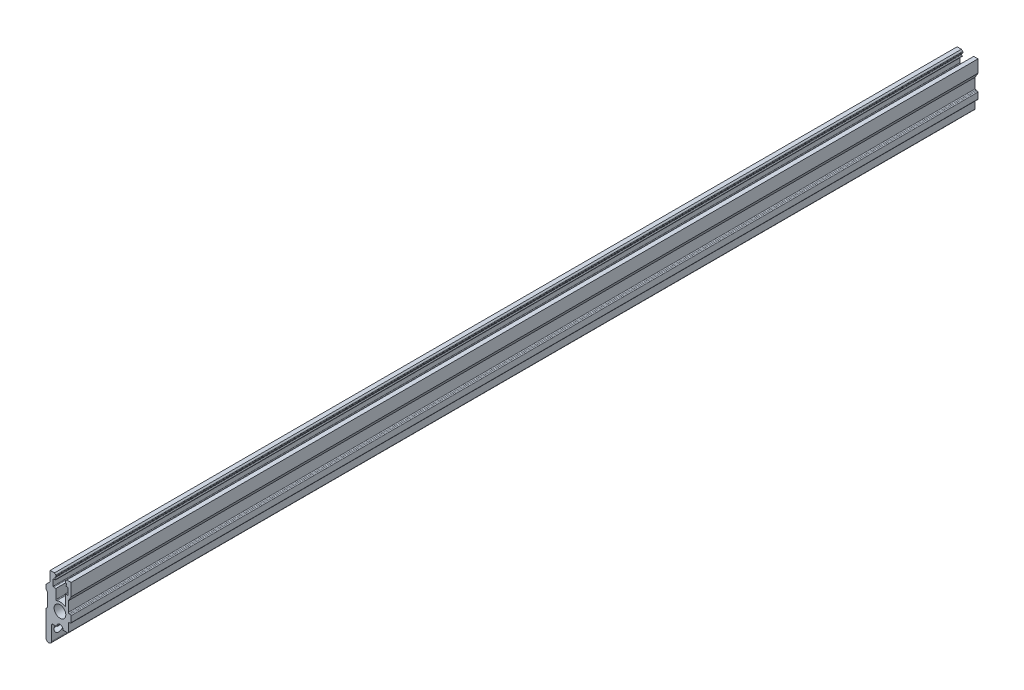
SolidWorks part; units mm, degrees
ref_plane "前视基准面" through (0, 0, 0) normal (0, 0, 1) x (1, 0, 0)
ref_plane "上视基准面" through (0, 0, 0) normal (0, 1, 0) x (1, 0, 0)
ref_plane "右视基准面" through (0, 0, 0) normal (1, 0, 0) x (0, 0, -1)
sketch "草图1" plane through (0, 0, 0) normal (0, 0, 1) x (1, 0, 0)
  line L0 (-2.3509, 8.9116) -> (-2.3509, 6.6116)
  line L1 (-2.3509, 8.9116) -> (-1.4509, 8.9116)
  line L2 (-1.4509, 8.9116) -> (-1.4509, 11.7916)
  line L3 (-1.4509, 11.7916) -> (-4.1259, 11.7916)
  line L4 (-4.1259, 11.7916) -> (-4.1259, 10.0616)
  line L5 (-4.1259, 10.0616) -> (-3.5009, 9.8916)
  line L6 (-3.5009, 9.8916) -> (-3.5009, 8.5216)
  line L7 (-3.5009, 8.5216) -> (-5.0009, 8.5216)
  line L8 (-5.0009, 8.5216) -> (-5.0009, 4.4416)
  line L9 (-5.0009, 4.4416) -> (-4.5507, 3.9414)
  line L10 (-4.5507, 3.9414) -> (-4.551, -1.0586)
  line L11 (-4.551, -1.0586) -> (-5.0009, -1.5584)
  line L12 (-5.0009, -1.5584) -> (-5.0009, -10.75)
  line L13 (-3.0009, -10.75) -> (-3.0009, -5.75)
  line L14 (2.9991, -5.05) -> (2.9991, -2.0584)
  line L15 (3.2991, -1.7584) -> (3.6991, -1.7584)
  line L16 (3.9991, -2.0584) -> (3.9991, -3.4584) construction
  line L17 (4.2991, -3.7584) -> (4.6991, -3.7584) construction
  line L18 (4.9991, -3.4584) -> (4.9991, 2.6416) construction
  line L19 (4.6991, 2.9416) -> (4.2991, 2.9416) construction
  line L20 (3.9991, 2.6416) -> (3.9991, 1.2416) construction
  line L21 (3.6991, 0.9416) -> (3.2991, 0.9416)
  line L22 (2.9991, 1.2416) -> (2.9991, 4.8054)
  line L23 (2.9991, 4.8054) -> (3.9991, 6.5374)
  line L24 (3.9991, 6.5374) -> (3.9991, 9.5216)
  line L25 (3.9991, 9.5216) -> (3.1241, 9.5216)
  line L26 (3.1241, 10.7916) -> (3.1241, 11.7916)
  line L27 (3.1241, 11.7916) -> (1.9491, 11.7916)
  line L28 (1.9491, 11.7916) -> (1.9491, 8.9116)
  line L29 (1.9491, 8.9116) -> (2.8491, 8.9116)
  line L30 (2.8491, 6.6116) -> (2.8491, 8.9116)
  line L31 (2.8491, 6.6116) -> (1.9491, 6.6116)
  line L32 (1.9491, 6.6116) -> (1.9491, 2.6797)
  line L33 (-1.4509, 2.9454) -> (-1.4509, 6.6116)
  line L34 (-1.4509, 6.6116) -> (-2.3509, 6.6116)
  line L35 (0, 0) -> (0, -5) construction
  line L36 (-1.05, -5) -> (-1.05, -5.15)
  line L37 (1.05, -5) -> (1.05, -5.15)
  line L38 (1.15, -5.25) -> (2.7991, -5.25)
  line L39 (-2.5009, -5.25) -> (-1.15, -5.25)
  line L40 (-1.4509, 10.3516) -> (1.9491, 10.3516) construction
  line L41 (-3.0009, -10.75) -> (-5.0009, -10.75) construction
  line L42 (0.2491, 10.3516) -> (0.2491, 6.8507) construction
  line L44 (3.9991, 0.6416) -> (3.9991, -1.4584)
  arc A0 (-5.0009, -10.75) -> (-3.0009, -10.75) centre (-4.0009, -10.75) ccw
  arc A1 (3.2991, -1.7584) -> (2.9991, -2.0584) centre (3.2991, -2.0584) ccw
  arc A2 (3.9991, -2.0584) -> (3.6991, -1.7584) centre (3.6991, -2.0584) ccw construction
  arc A3 (3.9991, -3.4584) -> (4.2991, -3.7584) centre (4.2991, -3.4584) ccw construction
  arc A4 (4.6991, -3.7584) -> (4.9991, -3.4584) centre (4.6991, -3.4584) ccw construction
  arc A5 (4.9991, 2.6416) -> (4.6991, 2.9416) centre (4.6991, 2.6416) ccw construction
  arc A6 (4.2991, 2.9416) -> (3.9991, 2.6416) centre (4.2991, 2.6416) ccw construction
  arc A7 (3.6991, 0.9416) -> (3.9991, 1.2416) centre (3.6991, 1.2416) ccw construction
  arc A8 (2.9991, 1.2416) -> (3.2991, 0.9416) centre (3.2991, 1.2416) ccw
  arc A9 (3.1241, 10.7916) -> (3.1241, 9.5216) centre (3.1841, 10.1566) ccw
  circle A10 centre (0, 0) radius 1.6
  arc A11 (1.6398, 2.5122) -> (-1.1727, 2.7613) centre (0, 0) ccw
  arc A12 (1.6398, 2.5122) -> (1.9491, 2.6797) centre (1.7491, 2.6797) ccw
  arc A13 (-1.4509, 2.9454) -> (-1.1727, 2.7613) centre (-1.2509, 2.9454) ccw
  arc A14 (1.05, -5) -> (-1.05, -5) centre (0, -5) ccw
  arc A15 (1.15, -5.25) -> (1.05, -5.15) centre (1.15, -5.15) cw
  arc A16 (-1.05, -5.15) -> (-1.15, -5.25) centre (-1.15, -5.15) cw
  arc A17 (3.6991, 0.9416) -> (3.9991, 0.6416) centre (3.6991, 0.6416) cw
  arc A18 (3.9991, -1.4584) -> (3.6991, -1.7584) centre (3.6991, -1.4584) cw
  arc A19 (2.7991, -5.25) -> (2.9991, -5.05) centre (2.7991, -5.05) ccw
  arc A20 (-3.0009, -5.75) -> (-2.5009, -5.25) centre (-2.5009, -5.75) cw
  point P72 (1.05, -5.25)
  dimension "D1" = 2.1
  dimension "D3" = 5
  dimension "D4" = 0.1
  dimension "D6" = 0.3
  dimension "D2" = 10.75
  dimension "D5" = 5.2
extrude "凸台-拉伸1" add sketch "草图1" along normal mid plane 325.12
sketch "草图9" plane through (0, 0, -162.56) normal (0, 0, -1) x (-1, 0, 0)
  line L0 (2.3509, 8.9116) -> (1.4509, 8.9116) construction
  line L1 (2.4509, 8.9116) -> (-2.9491, 8.9116)
  line L2 (2.4509, 8.9116) -> (2.4509, 6.4116)
  line L3 (2.4509, 6.4116) -> (-2.9491, 6.4116)
  line L4 (-2.9491, 8.9116) -> (-2.9491, 6.4116)
  line L5 (2.3509, 6.6116) -> (2.3509, 8.9116) construction
  line L6 (-2.8491, 8.9116) -> (-2.8491, 6.6116) construction
  line L7 (-2.8491, 6.6116) -> (-1.9491, 6.6116) construction
  dimension "D1" = 0.1
  dimension "D2" = 0.1
  dimension "D3" = 0.2
extrude "切除-拉伸7" cut sketch "草图9" against normal through all
fillet "圆角4" radius 0.2 4 edges at (-2.4509, 8.9116, 0) (-2.4509, 6.4116, 0) (2.9491, 8.9116, 0) (2.9491, 6.4116, 0)
sketch "草图2" plane through (0, 0, -162.56) normal (0, 0, -1) x (-1, 0, 0)
  circle A0 centre (0, 0) radius 2.1
  dimension "D1" = 4.2
extrude "切除-拉伸1" cut sketch "草图2" against normal blind 10
sketch "草图3" plane through (0, 0, 162.56) normal (0, 0, 1) x (1, 0, 0)
  circle A0 centre (0, 0) radius 2.1
  dimension "D1" = 4.2
extrude "切除-拉伸2" cut sketch "草图3" against normal blind 10
sketch "草图4" plane through (-5.0009, 0, 0) normal (-1, 0, 0) x (0, 0, 1)
  line L0 (-162.56, -1.5584) -> (-162.56, -10.75) construction
  line L1 (-162.56, -11.75) -> (162.56, -11.75) construction
  circle A0 centre (-160.02, -7.5) radius 1.65
  circle A1 centre (-154.94, -7.5) radius 1.65
  circle A2 centre (-149.86, -7.5) radius 1.65
  circle A3 centre (-144.78, -7.5) radius 1.65
  circle A4 centre (-139.7, -7.5) radius 1.65
  circle A5 centre (-134.62, -7.5) radius 1.65
  circle A6 centre (-129.54, -7.5) radius 1.65
  circle A7 centre (-124.46, -7.5) radius 1.65
  circle A8 centre (-119.38, -7.5) radius 1.65
  circle A9 centre (-114.3, -7.5) radius 1.65
  circle A10 centre (-109.22, -7.5) radius 1.65
  circle A11 centre (-104.14, -7.5) radius 1.65
  circle A12 centre (-99.06, -7.5) radius 1.65
  circle A13 centre (-93.98, -7.5) radius 1.65
  circle A14 centre (-88.9, -7.5) radius 1.65
  circle A15 centre (-83.82, -7.5) radius 1.65
  circle A16 centre (-78.74, -7.5) radius 1.65
  circle A17 centre (-73.66, -7.5) radius 1.65
  circle A18 centre (-68.58, -7.5) radius 1.65
  circle A19 centre (-63.5, -7.5) radius 1.65
  circle A20 centre (-58.42, -7.5) radius 1.65
  circle A21 centre (-53.34, -7.5) radius 1.65
  circle A22 centre (-48.26, -7.5) radius 1.65
  circle A23 centre (-43.18, -7.5) radius 1.65
  circle A24 centre (-38.1, -7.5) radius 1.65
  circle A25 centre (-33.02, -7.5) radius 1.65
  circle A26 centre (-27.94, -7.5) radius 1.65
  circle A27 centre (-22.86, -7.5) radius 1.65
  circle A28 centre (-17.78, -7.5) radius 1.65
  circle A29 centre (-12.7, -7.5) radius 1.65
  circle A30 centre (-7.62, -7.5) radius 1.65
  circle A31 centre (-2.54, -7.5) radius 1.65
  circle A32 centre (2.54, -7.5) radius 1.65
  circle A33 centre (7.62, -7.5) radius 1.65
  circle A34 centre (12.7, -7.5) radius 1.65
  circle A35 centre (17.78, -7.5) radius 1.65
  circle A36 centre (22.86, -7.5) radius 1.65
  circle A37 centre (27.94, -7.5) radius 1.65
  circle A38 centre (33.02, -7.5) radius 1.65
  circle A39 centre (38.1, -7.5) radius 1.65
  circle A40 centre (43.18, -7.5) radius 1.65
  circle A41 centre (48.26, -7.5) radius 1.65
  circle A42 centre (53.34, -7.5) radius 1.65
  circle A43 centre (58.42, -7.5) radius 1.65
  circle A44 centre (63.5, -7.5) radius 1.65
  circle A45 centre (68.58, -7.5) radius 1.65
  circle A46 centre (73.66, -7.5) radius 1.65
  circle A47 centre (78.74, -7.5) radius 1.65
  circle A48 centre (83.82, -7.5) radius 1.65
  circle A49 centre (88.9, -7.5) radius 1.65
  circle A50 centre (93.98, -7.5) radius 1.65
  circle A51 centre (99.06, -7.5) radius 1.65
  circle A52 centre (104.14, -7.5) radius 1.65
  circle A53 centre (109.22, -7.5) radius 1.65
  circle A54 centre (114.3, -7.5) radius 1.65
  circle A55 centre (119.38, -7.5) radius 1.65
  circle A56 centre (124.46, -7.5) radius 1.65
  circle A57 centre (129.54, -7.5) radius 1.65
  circle A58 centre (134.62, -7.5) radius 1.65
  circle A59 centre (139.7, -7.5) radius 1.65
  circle A60 centre (144.78, -7.5) radius 1.65
  circle A61 centre (149.86, -7.5) radius 1.65
  circle A62 centre (154.94, -7.5) radius 1.65
  circle A63 centre (160.02, -7.5) radius 1.65
  circle A64 centre (165.1, -7.5) radius 1.65
  circle A65 centre (170.18, -7.5) radius 1.65
  circle A66 centre (175.26, -7.5) radius 1.65
  circle A67 centre (180.34, -7.5) radius 1.65
  circle A68 centre (185.42, -7.5) radius 1.65
  circle A69 centre (190.5, -7.5) radius 1.65
  circle A70 centre (195.58, -7.5) radius 1.65
  circle A71 centre (200.66, -7.5) radius 1.65
  circle A72 centre (205.74, -7.5) radius 1.65
  circle A73 centre (210.82, -7.5) radius 1.65
  circle A74 centre (215.9, -7.5) radius 1.65
  circle A75 centre (220.98, -7.5) radius 1.65
  circle A76 centre (226.06, -7.5) radius 1.65
  circle A77 centre (231.14, -7.5) radius 1.65
  circle A78 centre (236.22, -7.5) radius 1.65
  circle A79 centre (241.3, -7.5) radius 1.65
  circle A80 centre (246.38, -7.5) radius 1.65
  circle A81 centre (251.46, -7.5) radius 1.65
  circle A82 centre (256.54, -7.5) radius 1.65
  circle A83 centre (261.62, -7.5) radius 1.65
  circle A84 centre (266.7, -7.5) radius 1.65
  dimension "D1" = 3.3
  dimension "D5" = 5.08
  dimension "D2" = 2.54
  dimension "D3" = 4.25
  dimension "D4" = 85
extrude "切除-拉伸3" cut sketch "草图4" against normal blind 12
sketch "草图5" plane through (0, 0, 162.56) normal (0, 0, 1) x (1, 0, 0)
  line L0 (1.9491, 8.9116) -> (2.7491, 8.9116) construction
  line L1 (1.9491, 8.9116) -> (3.9991, 8.9116)
  line L2 (1.9491, 8.9116) -> (1.9491, 11.7916)
  line L3 (1.9491, 11.7916) -> (3.9991, 11.7916)
  line L4 (3.9991, 8.9116) -> (3.9991, 11.7916)
  line L5 (3.1241, 11.7916) -> (1.9491, 11.7916) construction
  line L6 (3.9991, 6.5374) -> (3.9991, 9.5216) construction
  line L7 (-1.4509, 11.7916) -> (-4.1259, 11.7916) construction
  line L8 (-5.0009, 8.5216) -> (-2.7884, 8.5216)
  line L9 (-5.0009, 8.5216) -> (-5.0009, 11.7916)
  line L10 (-5.0009, 11.7916) -> (-2.7884, 11.7916)
  line L11 (-2.7884, 8.5216) -> (-2.7884, 11.7916)
extrude "凸台-拉伸2" add sketch "草图5" against normal up to surface (325.12 mm away)
sketch "草图6" plane through (0, 0, -162.56) normal (0, 0, -1) x (-1, 0, 0)
  line L0 (-1.9491, 9.4916) -> (1.4509, 9.4916) construction
  line L1 (-1.9491, 11.7916) -> (-1.9491, 8.9116) construction
  line L2 (1.4509, 8.9116) -> (1.4509, 11.7916) construction
  line L3 (1.4509, 11.7916) -> (5.0009, 11.7916) construction
  line L4 (-2.3491, 8.9916) -> (1.8509, 8.9916)
  line L5 (-2.3491, 8.9916) -> (-2.3491, 9.9916)
  line L6 (-2.3491, 9.9916) -> (1.8509, 9.9916)
  line L7 (1.8509, 8.9916) -> (1.8509, 9.9916)
  line L8 (-2.3491, 8.9916) -> (1.8509, 9.9916) construction
  line L9 (-2.3491, 9.9916) -> (1.8509, 8.9916) construction
  point P6 (-0.2491, 9.4916)
  dimension "D1" = 1
  dimension "D2" = 4.2
  dimension "D3" = 1.8
extrude "切除-拉伸4" cut sketch "草图6" against normal through all
sketch "草图8" plane through (0, 0, -162.56) normal (0, 0, -1) x (-1, 0, 0)
  line L0 (5.0009, 11.7916) -> (5.0009, 4.4416) construction
  line L1 (-3.9991, 11.7916) -> (5.0009, 11.7916)
  line L2 (-3.9991, 11.7916) -> (-3.9991, 11.0016)
  line L3 (-3.9991, 11.0016) -> (5.0009, 11.0016)
  line L4 (5.0009, 11.7916) -> (5.0009, 11.0016)
  dimension "D1" = 0.79
extrude "切除-拉伸6" cut sketch "草图8" against normal through all
fillet "圆角1" radius 0.5 4 edges at (-1.8509, 9.9916, 0) (-1.8509, 8.9916, 0) (2.3491, 9.9916, 0) (2.3491, 8.9916, 0)
chamfer "倒角1" distance 0.5 angle 45 2 edges at (-1.4509, 11.0016, 0) (1.9491, 11.0016, 0)
fillet "圆角2" radius 0.2 6 edges at (1.9491, 10.5016, 0) (-1.4509, 10.5016, 0) (-1.4509, 8.9916, 0) (-1.4509, 9.9916, 0) (1.9491, 8.9916, 0) (1.9491, 9.9916, 0)
fillet "圆角3" radius 0.1 2 edges at (-1.4509, 8.9116, 0) (1.9491, 8.9116, 0)
sketch "草图7" plane through (0, 0, -162.56) normal (0, 0, -1) x (-1, 0, 0)
  line L0 (5.0009, 11.0016) -> (3.5009, 11.0016)
  line L2 (3.5009, 11.0016) -> (3.5009, 7.4416)
  line L3 (3.5009, 7.4416) -> (5.0009, 5.9416)
  line L4 (5.0009, 11.0016) -> (5.0009, 4.4416) construction
  line L5 (5.0009, 5.9416) -> (5.0009, 11.0016)
  line L6 (1.4509, 10.1341) -> (1.4509, 10.4187) construction
  line L7 (1.9509, 11.0016) -> (5.0009, 11.0016) construction
  dimension "D1" = 2.05
  dimension "D2" = 1.5
  dimension "D3" = 45
extrude "切除-拉伸5" cut sketch "草图7" against normal through all
